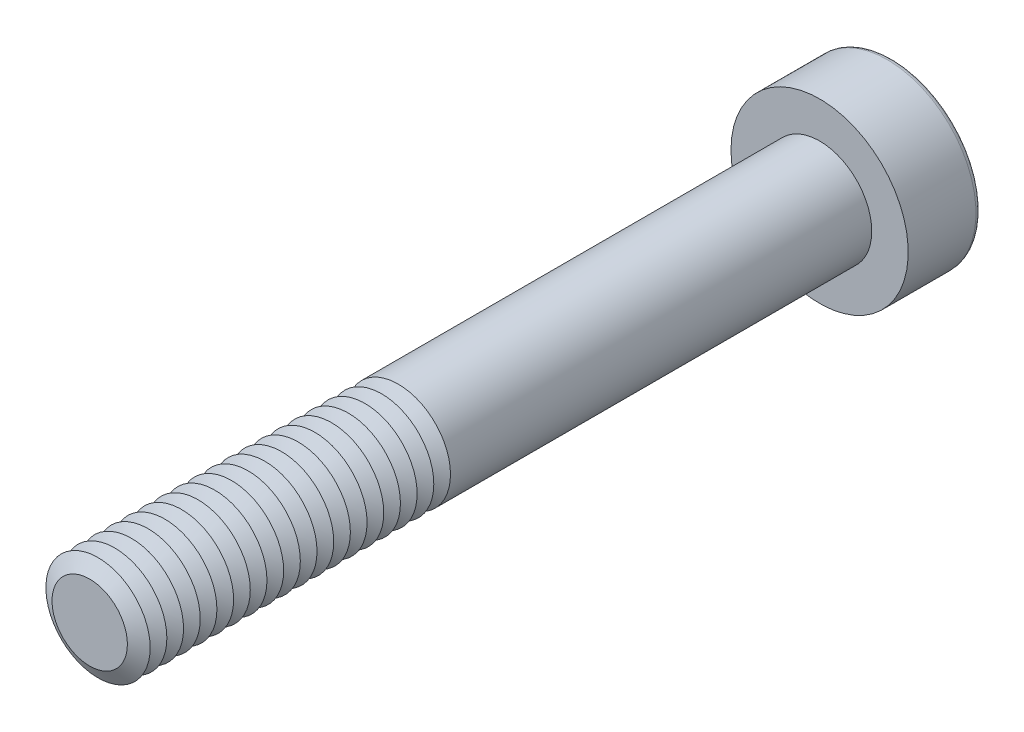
SolidWorks part; units mm, degrees
ref_plane "Front Plane" through (0, 0, 0) normal (0, 0, 1) x (1, 0, 0)
ref_plane "Top Plane" through (0, 0, 0) normal (0, 1, 0) x (1, 0, 0)
ref_plane "Right Plane" through (0, 0, 0) normal (1, 0, 0) x (0, 0, -1)
sketch "Sketch1" plane through (0, 0, 0) normal (0, 0, 1) x (1, 0, 0)
  circle A0 centre (0, 0) radius 2.5
  dimension "D1" = 5
extrude "Boss-Extrude1" add sketch "Sketch1" along normal blind 35
sketch "Sketch2" plane through (0, 0, 0) normal (0, 0, -1) x (-1, 0, 0)
  circle A0 centre (0, 0) radius 4.25
  dimension "D1" = 8.5
extrude "Boss-Extrude2" add sketch "Sketch2" along normal blind 3.5
sketch "Sketch3" plane through (0, 0, -3.5) normal (0, 0, -1) x (-1, 0, 0)
  line L1 (-0.866, 1.5) -> (-1.7321, 0)
  line L2 (-1.7321, 0) -> (-0.866, -1.5)
  line L3 (-0.866, -1.5) -> (0.866, -1.5)
  line L4 (0.866, -1.5) -> (1.7321, 0)
  line L5 (1.7321, 0) -> (0.866, 1.5)
  line L6 (0.866, 1.5) -> (-0.866, 1.5)
  circle A0 centre (0, 0) radius 1.5 construction
  dimension "D1" = 3
extrude "Cut-Extrude1" cut sketch "Sketch3" against normal blind 2.25
fillet "Fillet1" radius 0.25 1 edges at (-4.25, 0, -3.5)
sketch "Sketch4" plane through (0, 0, -1.25) normal (0, 0, -1) x (-1, 0, 0)
  line L0 (0.866, -1.5) -> (1.7321, 0) construction
  circle A0 centre (0, 0) radius 1.5
extrude "Cut-Extrude2" cut sketch "Sketch4" against normal through all draft 60
sketch "Sketch5" plane through (0, 0, -3.5) normal (0, 0, -1) x (-1, 0, 0)
  circle A0 centre (0, 0) radius 1.7321
extrude "Cut-Extrude3" cut sketch "Sketch5" against normal through all draft 75
sketch "Sketch7" plane through (0, 0, 0) normal (1, 0, 0) x (0, 0, -1)
  line L25 (-35, 1.8072) -> (-34.6, 2.5)
  line L26 (-35, 2.5) -> (-35, -2.5) construction
  line L27 (-34.6, 2.5) -> (-35.4, 2.5)
  line L28 (-35.4, 2.5) -> (-35, 1.8072)
  line L29 (0, 2.5) -> (-35, 2.5) construction
  dimension "D1" = 0.8
revolve "Cut-Revolve1" cut sketch "Sketch7" angle 360 about axis through (0, 0, 35) along (0, 0, -1)
pattern_linear "LPattern1" count 19 spacing 0.8 along (0, 0, -1) of "Cut-Revolve1"
